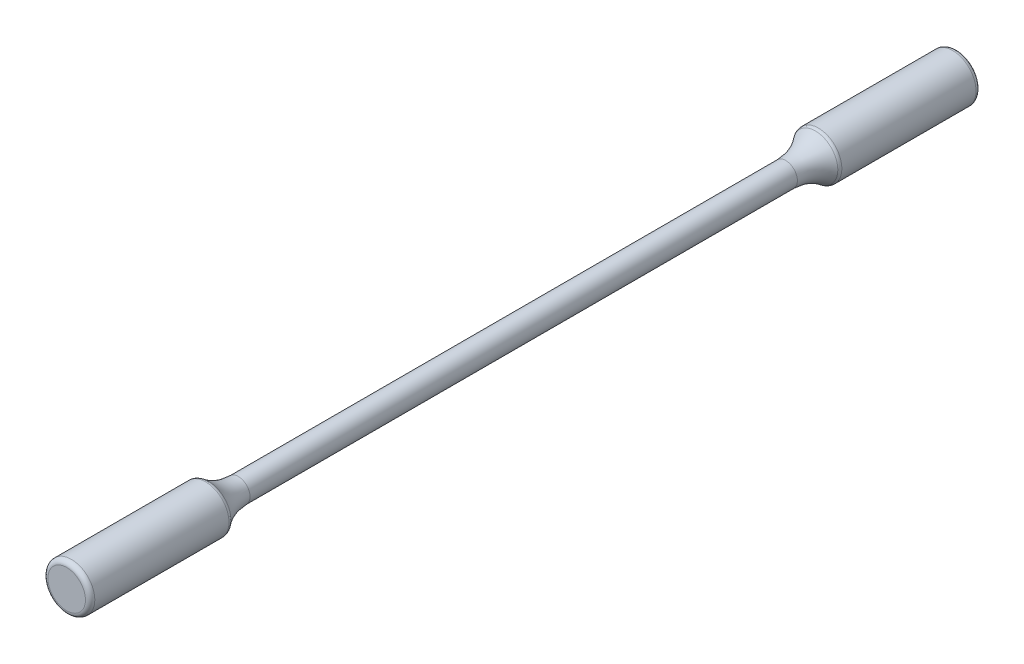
SolidWorks part; units mm, degrees
ref_plane "前基準面" through (0, 0, 0) normal (0, 0, 1) x (1, 0, 0)
ref_plane "上基準面" through (0, 0, 0) normal (0, 1, 0) x (1, 0, 0)
ref_plane "右基準面" through (0, 0, 0) normal (1, 0, 0) x (0, 0, -1)
sketch "草圖1" plane through (0, 0, 0) normal (0, 0, 1) x (1, 0, 0)
  circle A0 centre (0, 0) radius 2.5
  dimension "D1" = 5
extrude "填料-伸長1" add sketch "草圖1" along normal blind 130
sketch "草圖2" plane through (0, 0, 130) normal (0, 0, 1) x (1, 0, 0)
  circle A0 centre (0, 0) radius 5
  dimension "D1" = 10
extrude "填料-伸長2" add sketch "草圖2" along normal blind 30
sketch "草圖3" plane through (0, 0, 0) normal (0, 0, -1) x (-1, 0, 0)
  circle A0 centre (0, 0) radius 5
  dimension "D1" = 10
extrude "填料-伸長3" add sketch "草圖3" along normal blind 30
fillet "圓角2" radius 10 2 edges at (2.5, 0, 0) (2.5, 0, 130)
fillet "圓角3" radius 1 2 edges at (-5, 0, -30) (5, 0, 160)
fillet "圓角4" radius 1 2 edges at (-5, 0, 0) (5, 0, 130)
